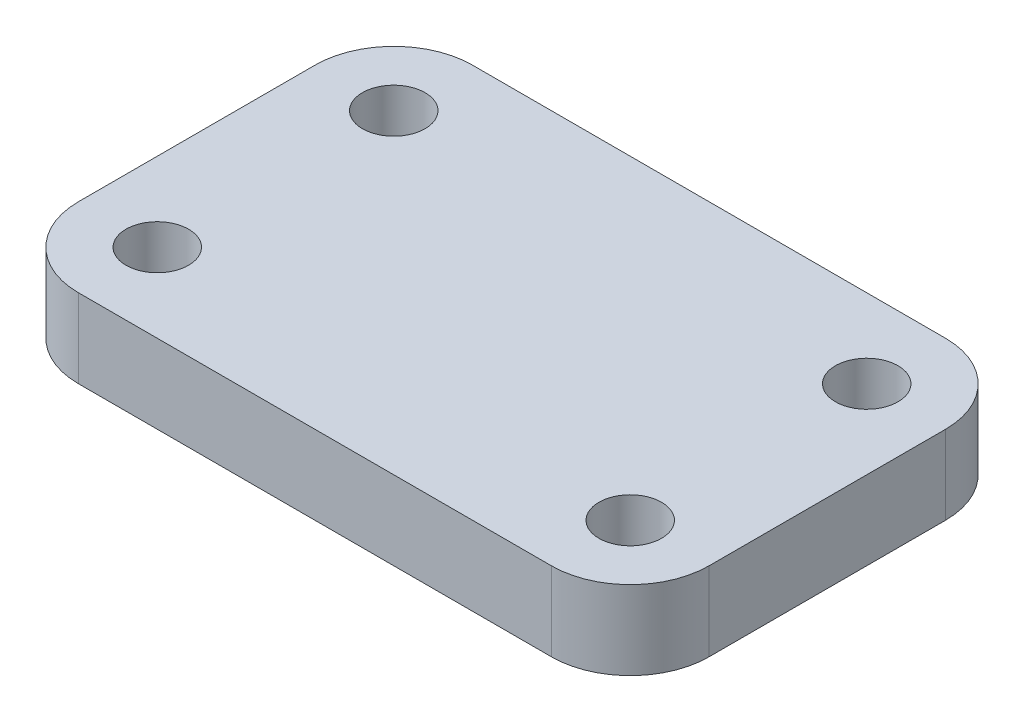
SolidWorks part; units mm, degrees
ref_plane "Front Plane" through (0, 0, 0) normal (0, 0, 1) x (1, 0, 0)
ref_plane "Top Plane" through (0, 0, 0) normal (0, 1, 0) x (1, 0, 0)
ref_plane "Right Plane" through (0, 0, 0) normal (1, 0, 0) x (0, 0, -1)
sketch "Sketch1" plane through (0, 0, 0) normal (0, 1, 0) x (1, 0, 0)
  line L1 (0, 0) -> (101.6, 0)
  line L2 (0, 0) -> (0, 63.5)
  line L3 (0, 63.5) -> (101.6, 63.5)
  line L4 (101.6, 0) -> (101.6, 63.5)
  dimension "D1" = 101.6
  dimension "D2" = 63.5
extrude "Extrude1" add sketch "Sketch1" along normal blind 12.7
fillet "Fillet1" radius 12.7 4 edges at (101.6, 6.35, -63.5) (101.6, 6.35, 0) (0, 6.35, -63.5) (0, 6.35, 0)
hole_wizard "3/8 Clearance Hole1" positions "Sketch3" profile "Sketch2" hole size "3/8" standard "Ansi Inch"
sketch "Sketch3" plane through (0, 12.7, 0) normal (0, 1, 0) x (-1, 0, 0)
  line L0 (-88.9, -63.5) -> (-12.7, -63.5) construction
  line L1 (0, -50.8) -> (0, -12.7) construction
  line L2 (-12.7, 0) -> (-88.9, 0) construction
  line L3 (-101.6, -12.7) -> (-101.6, -50.8) construction
  point P0 (-12.7, -12.7)
  point P1 (-12.7, -50.8)
  point P3 (-88.9, -50.8)
  point P5 (-88.9, -12.7)
  point P20 (-82.2841, 0)
  dimension "D1" = 12.7
  dimension "D2" = 12.7
  dimension "D3" = 12.7
  dimension "D4" = 12.7
  dimension "D5" = 12.7
  dimension "D6" = 12.7
  dimension "D7" = 12.7
  dimension "D8" = 12.7
sketch "Sketch2" plane through (12.7, 12.7, -12.7) normal (1, 0, 0) x (0, 0, 1)
  line L0 (0, 0) -> (0, 12.7)
  line L1 (0, 12.7) -> (5.0419, 12.7)
  line L2 (5.0419, 12.7) -> (5.0419, 0)
  line L5 (5.0419, 0) -> (0, 0)
  line L11 (0, -6.35) -> (0, 107.95) construction
  dimension "Thru Hole Dia." = 10.0838
  dimension "Thru Hole Depth" = 12.7
